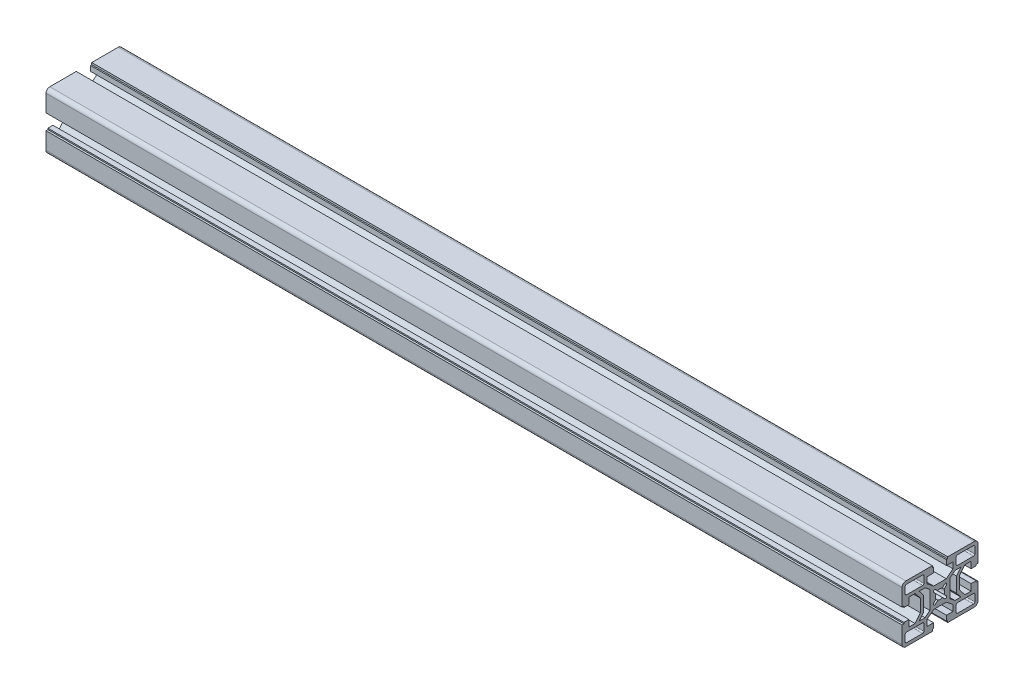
SolidWorks part; units mm, degrees
ref_plane "Plan de face" through (0, 0, 0) normal (0, 0, 1) x (1, 0, 0)
ref_plane "Plan de dessus" through (0, 0, 0) normal (0, 1, 0) x (1, 0, 0)
ref_plane "Plan de droite" through (0, 0, 0) normal (1, 0, 0) x (0, 0, -1)
sketch "Esquisse2"
extrude "Boss.-Extru.2" add sketch "Esquisse2" along normal blind 676
equation "\"D8@Esquisse2\"=\"D3@Esquisse2\""
equation "\"D9@Esquisse2\"=\"D4@Esquisse2\""
equation "\"D12@Esquisse2\"=\"D13@Esquisse2\""
equation "\"D14@Esquisse2\"=\"D15@Esquisse2\""
equation "\"D16@Esquisse2\"=\"D17@Esquisse2\""
equation "\"D18@Esquisse2\"=\"D17@Esquisse2\""
equation "\"D19@Esquisse2\"=\"D17@Esquisse2\""
equation "\"D6@Esquisse2\"=\"D17@Esquisse2\""
equation "\"D5@Esquisse2\"=\"D17@Esquisse2\""
equation "\"D21@Esquisse2\"=\"D20@Esquisse2\""
equation "\"D23@Esquisse2\"=\"D22@Esquisse2\""
equation "\"D24@Esquisse2\"=\"D17@Esquisse2\""
